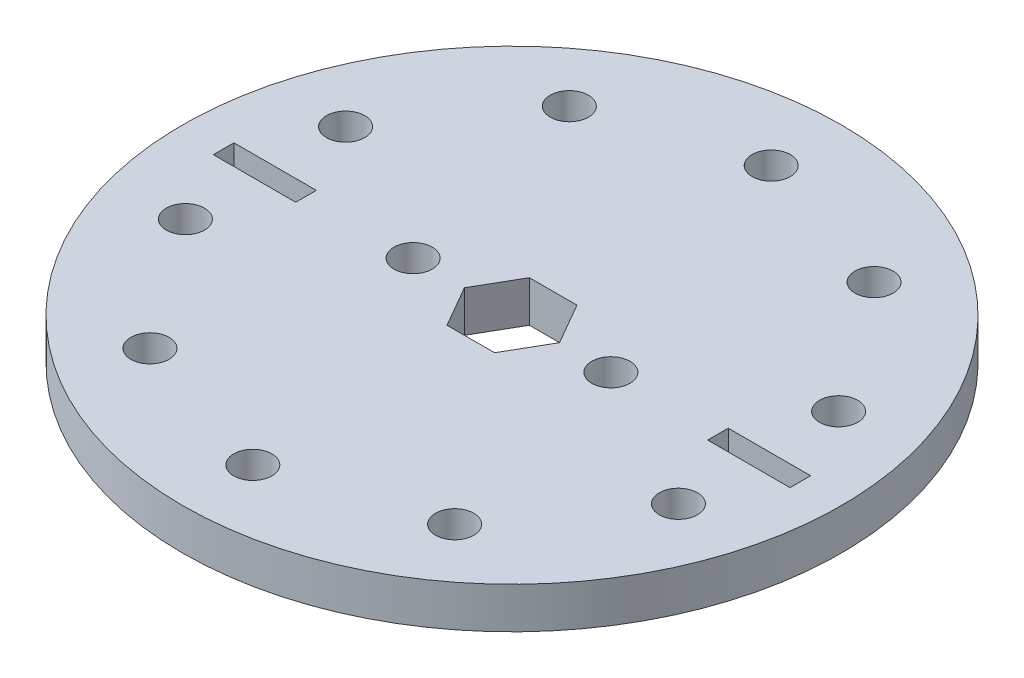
SolidWorks part; units mm, degrees
ref_plane "Front Plane" through (0, 0, 0) normal (0, 0, 1) x (1, 0, 0)
ref_plane "Top Plane" through (0, 0, 0) normal (0, 1, 0) x (1, 0, 0)
ref_plane "Right Plane" through (0, 0, 0) normal (1, 0, 0) x (0, 0, -1)
sketch "Sketch1" plane through (0, 0, 0) normal (0, 1, 0) x (1, 0, 0)
  line L0 (-52.8667, 0) -> (50.5636, 0) construction
  line L1 (1.8331, 3.175) -> (-1.8331, 3.175)
  line L2 (-1.8331, 3.175) -> (-3.6662, 0)
  line L3 (-3.6662, 0) -> (-1.8331, -3.175)
  line L4 (-1.8331, -3.175) -> (1.8331, -3.175)
  line L5 (1.8331, -3.175) -> (3.6662, 0)
  line L6 (3.6662, 0) -> (1.8331, 3.175)
  line L7 (0, 64.4869) -> (0, -49.412) construction
  circle A0 centre (0, 0) radius 25.4
  circle A1 centre (0, 0) radius 3.175 construction
  dimension "D1" = 50.8
  dimension "D2" = 6.35
extrude "Boss-Extrude1" add sketch "Sketch1" along normal blind 3.175
hole_wizard "#4 Clearance Hole1" positions "Sketch4" profile "Sketch2" hole size "#4" standard "ANSI Inch"
sketch "Sketch4" plane through (0, 3.175, 0) normal (0, 1, 0) x (1, 0, 0)
  line L1 (0, 19.9778) -> (-11.7426, 16.1624) construction
  line L2 (-11.7426, 16.1624) -> (-19, 6.1735) construction
  line L3 (-19, 6.1735) -> (-19, -6.1735) construction
  line L4 (-19, -6.1735) -> (-11.7426, -16.1624) construction
  line L5 (-11.7426, -16.1624) -> (0, -19.9778) construction
  line L6 (0, -19.9778) -> (11.7426, -16.1624) construction
  line L7 (11.7426, -16.1624) -> (19, -6.1735) construction
  line L8 (19, -6.1735) -> (19, 6.1735) construction
  line L9 (19, 6.1735) -> (11.7426, 16.1624) construction
  line L10 (11.7426, 16.1624) -> (0, 19.9778) construction
  line L12 (0, 0) -> (19, 6.1735) construction
  line L15 (0, 0) -> (49.099, 0) construction
  circle A0 centre (0, 0) radius 19 construction
  circle A1 centre (0, 0) radius 7.62 construction
  point P3 (0, 19.9778)
  point P4 (-11.7426, 16.1624)
  point P5 (-19, 6.1735)
  point P6 (-19, -6.1735)
  point P7 (-11.7426, -16.1624)
  point P8 (0, -19.9778)
  point P9 (11.7426, -16.1624)
  point P10 (19, -6.1735)
  point P11 (19, 6.1735)
  point P12 (11.7426, 16.1624)
  point P61 (-7.62, 0)
  point P63 (7.62, 0)
  dimension "D1" = 38
  dimension "D3" = 15.24
  dimension "D2" = 18
sketch "Sketch2" plane through (0, 3.175, -19.9778) normal (1, 0, 0) x (0, 0, 1)
  line L0 (0, 0) -> (0, 3.175)
  line L1 (0, 3.175) -> (1.4732, 3.175)
  line L2 (1.4732, 3.175) -> (1.4732, 0)
  line L5 (1.4732, 0) -> (0, 0)
  line L11 (0, -6.35) -> (0, 107.95) construction
  dimension "Thru Hole Dia." = 2.9464
  dimension "Thru Hole Depth" = 3.175
sketch "Sketch5" plane through (0, 3.175, 0) normal (0, 1, 0) x (1, 0, 0)
  line L0 (-25.4, 0) -> (25.4, 0) construction
  line L1 (0, 3.175) -> (0, -3.175) construction
  line L2 (1.8331, 3.175) -> (-1.8331, 3.175) construction
  line L3 (-1.8331, -3.175) -> (1.8331, -3.175) construction
  line L4 (15.875, 0.7937) -> (15.875, -0.7938)
  line L5 (-22.225, 0.7937) -> (-15.875, 0.7937)
  line L6 (-22.225, 0.7937) -> (-22.225, -0.7938)
  line L7 (-22.225, -0.7938) -> (-15.875, -0.7938)
  line L8 (-15.875, 0.7937) -> (-15.875, -0.7938)
  line L9 (22.225, 0.7937) -> (22.225, -0.7938)
  line L10 (22.225, -0.7938) -> (15.875, -0.7938)
  line L11 (22.225, 0.7937) -> (15.875, 0.7937)
  circle A0 centre (0, 0) radius 25.4 construction
  point P15 (-22.225, 0)
  dimension "D1" = 6.35
  dimension "D2" = 1.5875
  dimension "D3" = 3.175
extrude "Cut-Extrude1" cut sketch "Sketch5" against normal through all
